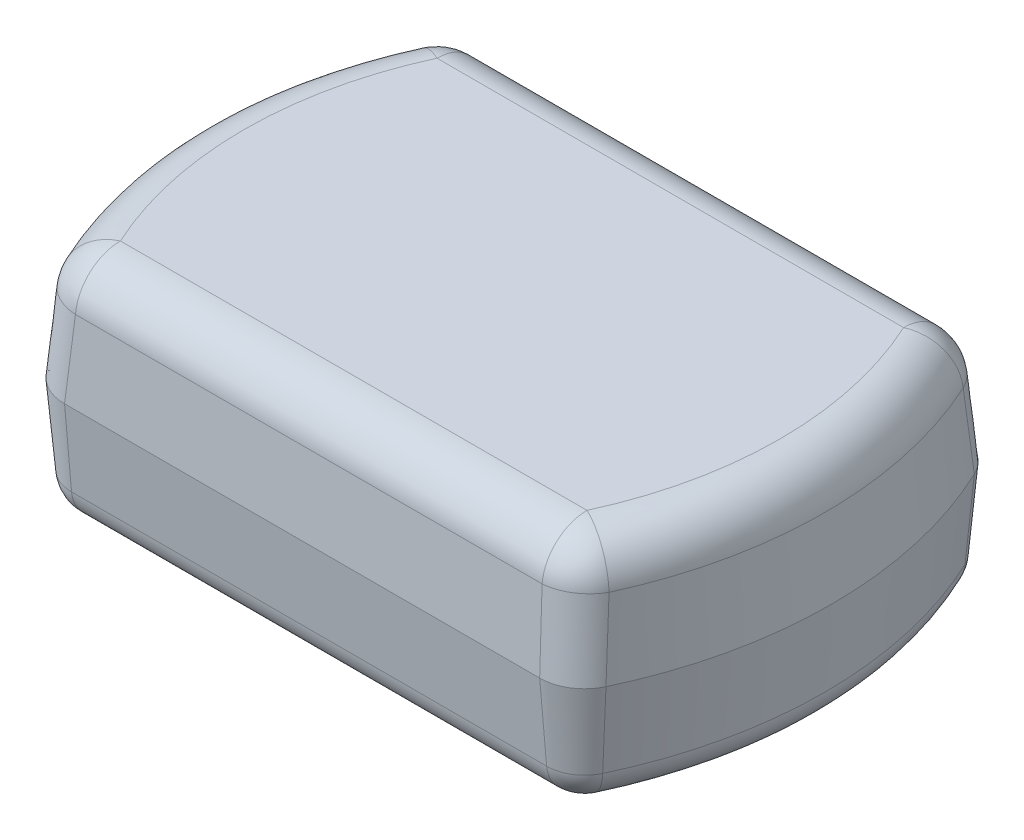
SolidWorks part; units mm, degrees
ref_plane "Front" through (0, 0, 0) normal (0, 0, 1) x (1, 0, 0)
ref_plane "Top" through (0, 0, 0) normal (0, 1, 0) x (1, 0, 0)
ref_plane "Right" through (0, 0, 0) normal (1, 0, 0) x (0, 0, -1)
sketch "Sketch1" plane through (0, 0, 0) normal (0, 1, 0) x (1, 0, 0)
  line L0 (58.7231, 93.048) -> (58.7231, 0) construction
  line L1 (0, 0) -> (117.4462, 0)
  line L2 (0, 0) -> (0, 93.048) construction
  line L3 (0, 93.048) -> (117.4462, 93.048)
  line L4 (117.4462, 0) -> (117.4462, 93.048) construction
  arc A0 (0, 93.048) -> (0, 0) centre (83.2747, 46.524) ccw
  arc A1 (117.4462, 93.048) -> (117.4462, 0) centre (34.1715, 46.524) cw
extrude "Extrude1" add sketch "Sketch1" along normal blind 26 draft 5
fillet "Fillet1" radius 10 4 edges
fillet "Fillet2" radius 10 8 edges at (2.9998, 26, -3.3578) (-9.8401, 26, -46.524) (1.295, 26, -88.5905) (58.7231, 26, -90.7733) (114.4465, 26, -89.6902) (127.2864, 26, -46.524) (116.1512, 26, -4.4575) (58.7231, 26, -2.2747)
shell "Shell1" thickness 2
sketch "Sketch2" plane through (0, 0, 0) normal (0, -1, 0) x (1, 0, 0)
  line L2 (111.3796, 0) -> (6.0666, 0)
  line L3 (6.0666, -93.048) -> (111.3796, -93.048)
  line L4 (111.3796, 0) -> (6.0666, 0)
  line L5 (6.0666, -93.048) -> (111.3796, -93.048)
  arc A2 (120.383, -87.3497) -> (120.383, -5.6983) centre (34.1715, -46.524) ccw
  arc A3 (-2.9368, -5.6983) -> (-2.9368, -87.3497) centre (83.2747, -46.524) ccw
  arc A4 (120.383, -87.3497) -> (120.383, -5.6983) centre (34.1715, -46.524) ccw
  arc A5 (-2.9368, -5.6983) -> (-2.9368, -87.3497) centre (83.2747, -46.524) ccw
  spline S4 degree 3 poles (-1416.2315, -1283.5103) (-195.1085, -360.2037) (156.2548, -45.7157) (118.5337, -3.0124) (118.1948, -2.6796) (117.4831, -2.0734) (117.1081, -1.7969) (116.517, -1.4222) (116.3152, -1.304) (115.9018, -1.0811) (115.6894, -0.9761) (115.0461, -0.6863) (114.1696, -0.3641) (113.2566, -0.1667) (81.2779, 4.3993) (19.4613, -141.4096) (1985.0816, -687.6113) knots -14.816603 -14.816603 -14.816603 -14.816603 0.25 0.25 0.375 0.375 0.5 0.5 0.5625 0.5625 0.625 0.625 0.75 0.875 0.875 9.329058 9.329058 9.329058 9.329058 only from (120.383, -5.6983) to (111.3796, 0)
  spline S5 degree 3 poles (503.2766, -1935.6415) (191.4377, -436.8669) (57.5868, 15.2934) (2.8477, -0.5218) (2.4018, -0.6857) (1.5493, -1.0694) (1.139, -1.2901) (0.5473, -1.6639) (0.3541, -1.7957) (-0.0243, -2.074) (-0.2101, -2.221) (-0.7473, -2.6783) (-1.4137, -3.3326) (-1.9828, -4.0733) (-19.796, -31.0208) (85.5262, -149.2935) (1420.431, 1393.4045) knots -14.816701 -14.816701 -14.816701 -14.816701 0.25 0.25 0.375 0.375 0.5 0.5 0.5625 0.5625 0.625 0.625 0.75 0.875 0.875 9.329031 9.329031 9.329031 9.329031 only from (6.0666, 0) to (-2.9368, -5.6983)
  spline S6 degree 3 poles (1533.6777, 1190.4622) (312.5548, 267.1556) (-38.8086, -47.3323) (-1.0875, -90.0356) (-0.7485, -90.3684) (-0.0369, -90.9747) (0.3381, -91.2511) (0.9292, -91.6258) (1.131, -91.7441) (1.5445, -91.9669) (1.7569, -92.0719) (2.4001, -92.3618) (3.2766, -92.684) (4.1897, -92.8813) (36.1684, -97.4474) (97.9849, 48.3615) (-1867.6354, 594.5633) knots -14.816603 -14.816603 -14.816603 -14.816603 0.25 0.25 0.375 0.375 0.5 0.5 0.5625 0.5625 0.625 0.625 0.75 0.875 0.875 9.329058 9.329058 9.329058 9.329058 only from (-2.9368, -87.3497) to (6.0666, -93.048)
  spline S7 degree 3 poles (-385.8304, 1842.5935) (-73.9914, 343.8188) (59.8595, -108.3415) (114.5986, -92.5262) (115.0444, -92.3623) (115.8969, -91.9786) (116.3072, -91.758) (116.8989, -91.3841) (117.0922, -91.2523) (117.4705, -90.9741) (117.6563, -90.827) (118.1936, -90.3697) (118.8599, -89.7155) (119.429, -88.9747) (137.2422, -62.0272) (31.92, 56.2454) (-1302.9848, -1486.4525) knots -14.816701 -14.816701 -14.816701 -14.816701 0.25 0.25 0.375 0.375 0.5 0.5 0.5625 0.5625 0.625 0.625 0.75 0.875 0.875 9.329031 9.329031 9.329031 9.329031 only from (111.3796, -93.048) to (120.383, -87.3497)
  spline S8 degree 3 poles (120.383, -5.6983) (119.9786, -4.8442) (119.4649, -4.0665) (118.5337, -3.0124) (118.1948, -2.6796) (117.4831, -2.0734) (117.1081, -1.7969) (116.517, -1.4222) (116.3152, -1.304) (115.9018, -1.0811) (115.6894, -0.9761) (115.0461, -0.6863) (114.1696, -0.3641) (113.2566, -0.1667) (112.3247, -0.0337) (111.8521, 0) (111.3796, 0) knots 0 0 0 0 0.25 0.25 0.375 0.375 0.5 0.5 0.5625 0.5625 0.625 0.625 0.75 0.875 0.875 1 1 1 1
  spline S9 degree 3 poles (6.0666, 0) (5.1216, 0) (4.1989, -0.1315) (2.8477, -0.5218) (2.4018, -0.6857) (1.5493, -1.0694) (1.139, -1.2901) (0.5473, -1.6639) (0.3541, -1.7957) (-0.0243, -2.074) (-0.2101, -2.221) (-0.7473, -2.6783) (-1.4137, -3.3326) (-1.9828, -4.0733) (-2.5019, -4.8586) (-2.7346, -5.2713) (-2.9368, -5.6983) knots 0 0 0 0 0.25 0.25 0.375 0.375 0.5 0.5 0.5625 0.5625 0.625 0.625 0.75 0.875 0.875 1 1 1 1
  spline S10 degree 3 poles (-2.9368, -87.3497) (-2.5323, -88.2038) (-2.0186, -88.9815) (-1.0875, -90.0356) (-0.7485, -90.3684) (-0.0369, -90.9747) (0.3381, -91.2511) (0.9292, -91.6258) (1.131, -91.7441) (1.5445, -91.9669) (1.7569, -92.0719) (2.4001, -92.3618) (3.2766, -92.684) (4.1897, -92.8813) (5.1215, -93.0144) (5.5941, -93.048) (6.0666, -93.048) knots 0 0 0 0 0.25 0.25 0.375 0.375 0.5 0.5 0.5625 0.5625 0.625 0.625 0.75 0.875 0.875 1 1 1 1
  spline S11 degree 3 poles (111.3796, -93.048) (112.3247, -93.048) (113.2474, -92.9166) (114.5986, -92.5262) (115.0444, -92.3623) (115.8969, -91.9786) (116.3072, -91.758) (116.8989, -91.3841) (117.0922, -91.2523) (117.4705, -90.9741) (117.6563, -90.827) (118.1936, -90.3697) (118.8599, -89.7155) (119.429, -88.9747) (119.9481, -88.1895) (120.1808, -87.7768) (120.383, -87.3497) knots 0 0 0 0 0.25 0.25 0.375 0.375 0.5 0.5 0.5625 0.5625 0.625 0.625 0.75 0.875 0.875 1 1 1 1
  dimension "D1" = 0
extrude "Extrude2" add sketch "Sketch2" along normal blind 25 draft 5 separate body
fillet "Fillet3" radius 8 16 edges at (114.7881, -25, -2.9729) (58.7231, -25, -2.1872) (1.2089, -25, -3.8902) (-9.9276, -25, -46.524) (2.6582, -25, -90.0751) (58.7231, -25, -90.8608) (116.2374, -25, -89.1579) (127.3738, -25, -46.524)
shell "Shell2" thickness 2
